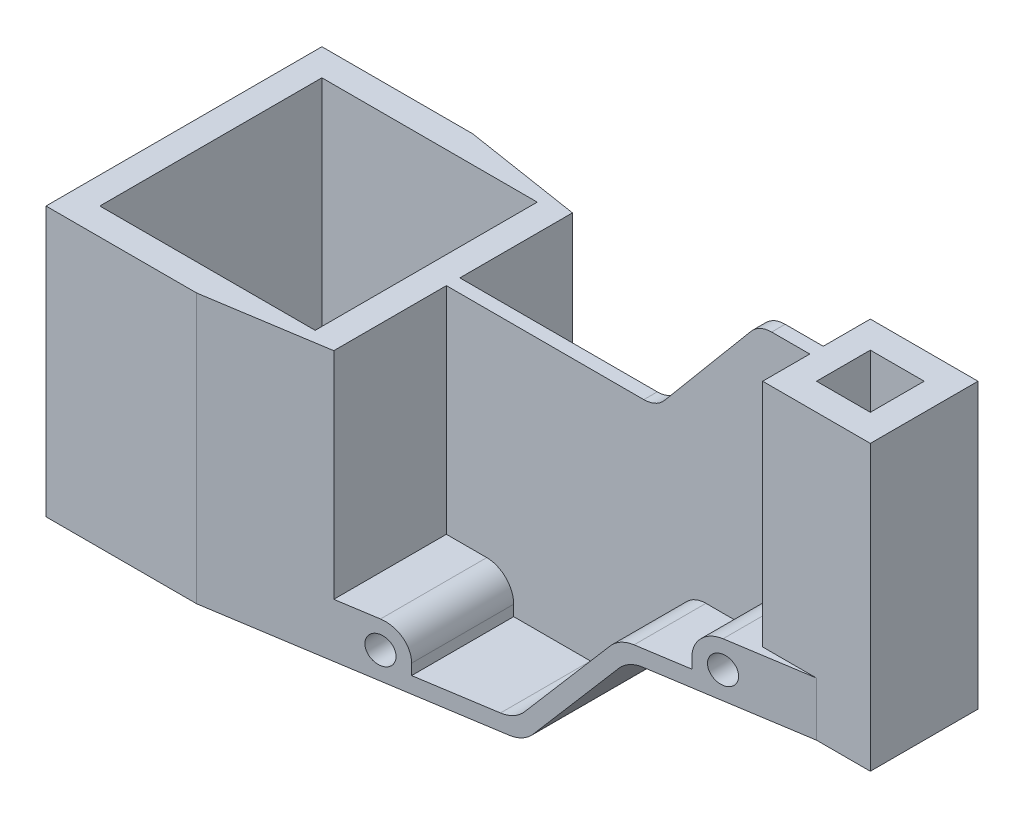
SolidWorks part; units mm, degrees
ref_plane "Front Plane" through (0, 0, 0) normal (0, 0, 1) x (1, 0, 0)
ref_plane "Top Plane" through (0, 0, 0) normal (0, 1, 0) x (1, 0, 0)
ref_plane "Right Plane" through (0, 0, 0) normal (1, 0, 0) x (0, 0, -1)
sketch "Esquisse1" plane through (0, 0, 0) normal (0, 0, 1) x (1, 0, 0)
  line L0 (0, 0) -> (-156.336, 0)
  line L1 (-156.336, 0) -> (-156.336, 100)
  line L2 (-156.336, 100) -> (-56.336, 100)
  line L3 (-56.336, 100) -> (-56.336, 20)
  line L4 (-56.336, 20) -> (-41.336, 20)
  line L5 (-31.336, 6) -> (-2.7978, 6)
  line L6 (4.8626, 9.5721) -> (32.4318, 42.4279)
  line L7 (40.0923, 46) -> (58.664, 46)
  line L8 (58.664, 46) -> (58.664, 50)
  line L10 (7.6604, 3.5721) -> (35.2297, 36.4279)
  line L11 (42.8901, 40) -> (98.664, 40)
  line L13 (-31.336, 10) -> (-31.336, 6)
  line L14 (98.664, 40) -> (98.664, 60)
  line L15 (98.664, 60) -> (68.664, 60)
  line L16 (-56.336, 100) -> (17.0078, 100)
  line L17 (24.6683, 103.5721) -> (56.8526, 141.9279)
  line L18 (64.513, 145.5) -> (118.664, 145.5)
  line L19 (118.664, 145.5) -> (118.664, 40)
  line L20 (118.664, 40) -> (98.664, 40)
  arc A1 (-2.7978, 6) -> (4.8626, 9.5721) centre (-2.7978, 16) ccw
  arc A2 (32.4318, 42.4279) -> (40.0923, 46) centre (40.0923, 36) cw
  arc A4 (35.2297, 36.4279) -> (42.8901, 40) centre (42.8901, 30) cw
  arc A5 (0, 0) -> (7.6604, 3.5721) centre (0, 10) ccw
  arc A6 (-41.336, 20) -> (-31.336, 10) centre (-41.336, 10) cw
  circle A7 centre (-41.336, 10) radius 5
  arc A8 (68.664, 60) -> (58.664, 50) centre (68.664, 50) ccw
  circle A9 centre (68.664, 50) radius 5
  arc A10 (56.8526, 141.9279) -> (64.513, 145.5) centre (64.513, 135.5) cw
  arc A11 (17.0078, 100) -> (24.6683, 103.5721) centre (17.0078, 110) ccw
  point P30 (-106.336, 100)
  point P32 (38.664, 39.0631)
extrude "Boss.-Extru.1" add sketch "Esquisse1" along normal mid plane 102.5 contours L15 A8 L8 L7 A2 L6 A1 L5 L13 A6 L4 L3 L2 L1 L0 A5 L10 A4 L11 L14 A9 A7
sketch "Esquisse5" plane through (0, 0, 0) normal (0, 1, 0) x (1, 0, 0)
  line L0 (-100.336, -51.25) -> (98.664, -20)
  line L2 (98.664, -51.25) -> (98.664, 51.25) construction
  line L3 (98.664, -20) -> (98.664, -51.25)
  line L5 (98.664, 0) -> (75.5696, 0) construction
  line L7 (98.664, 20) -> (98.664, 51.25)
  line L8 (-100.336, 51.25) -> (98.664, 20)
  line L11 (-100.336, 51.25) -> (98.664, 51.25)
  line L12 (-100.336, -51.25) -> (98.664, -51.25)
  point P6 (98.664, 0)
extrude "Enlèv. mat.-Extru.1" cut sketch "Esquisse5" along normal through all
sketch "Esquisse8" plane through (0, 60, 0) normal (0, 1, 0) x (1, 0, 0)
  line L0 (98.664, -20) -> (98.664, 20) construction
  line L1 (78.664, -20) -> (118.664, -20)
  line L2 (78.664, -20) -> (78.664, 20)
  line L3 (78.664, 20) -> (118.664, 20)
  line L4 (118.664, -20) -> (118.664, 20)
  line L5 (78.664, -20) -> (118.664, 20) construction
  line L6 (78.664, 20) -> (118.664, -20) construction
  point P0 (98.664, 0)
  dimension "D1" = 20
extrude "Boss.-Extru.2" add sketch "Esquisse8" along normal blind 85.5
sketch "Esquisse9" plane through (0, 40, 0) normal (0, -1, 0) x (1, 0, 0)
  line L4 (98.664, 20) -> (98.664, -20)
  line L5 (98.664, -20) -> (118.664, -20)
  line L6 (118.664, -20) -> (118.664, 20)
  line L7 (118.664, 20) -> (98.664, 20)
  line L8 (98.664, 20) -> (98.664, -20)
  line L9 (98.664, -20) -> (118.664, -20)
  line L10 (118.664, -20) -> (118.664, 20)
  line L11 (118.664, 20) -> (98.664, 20)
  dimension "D1" = 0
extrude "Boss.-Extru.3" add sketch "Esquisse9" against normal up to surface (20 mm away)
sketch "Esquisse11" plane through (0, 0, 0) normal (0, 0, 1) x (1, 0, 0)
  line L0 (24.6683, 103.5721) -> (56.8526, 141.9279) construction
  line L1 (64.513, 145.5) -> (118.664, 145.5) construction
  line L2 (78.664, 145.5) -> (78.664, 60) construction
  line L3 (98.664, 60) -> (68.664, 60) construction
  line L4 (58.664, 46) -> (58.664, 50) construction
  line L5 (40.0923, 46) -> (58.664, 46) construction
  line L6 (4.8626, 9.5721) -> (32.4318, 42.4279) construction
  line L7 (-31.336, 6) -> (-2.7978, 6) construction
  line L8 (-31.336, 10) -> (-31.336, 6) construction
  line L9 (-56.336, 20) -> (-41.336, 20) construction
  line L10 (-56.336, 100) -> (-56.336, 20) construction
  line L11 (-56.336, 100) -> (17.0078, 100) construction
  line L12 (24.6683, 103.5721) -> (56.8526, 141.9279)
  line L13 (64.513, 145.5) -> (78.664, 145.5)
  line L14 (78.664, 145.5) -> (78.664, 60)
  line L15 (78.664, 60) -> (68.664, 60)
  line L16 (58.664, 46) -> (58.664, 50)
  line L17 (40.0923, 46) -> (58.664, 46)
  line L18 (4.8626, 9.5721) -> (32.4318, 42.4279)
  line L19 (-31.336, 6) -> (-2.7978, 6)
  line L20 (-31.336, 10) -> (-31.336, 6)
  line L21 (-56.336, 20) -> (-41.336, 20)
  line L22 (-56.336, 100) -> (-56.336, 20)
  line L23 (-56.336, 100) -> (17.0078, 100)
  arc A0 (17.0078, 100) -> (24.6683, 103.5721) centre (17.0078, 110) ccw construction
  arc A1 (64.513, 145.5) -> (56.8526, 141.9279) centre (64.513, 135.5) ccw construction
  arc A2 (68.664, 60) -> (58.664, 50) centre (68.664, 50) ccw construction
  arc A3 (40.0923, 46) -> (32.4318, 42.4279) centre (40.0923, 36) ccw construction
  arc A4 (-2.7978, 6) -> (4.8626, 9.5721) centre (-2.7978, 16) ccw construction
  arc A5 (-31.336, 10) -> (-41.336, 20) centre (-41.336, 10) ccw construction
  arc A6 (17.0078, 100) -> (24.6683, 103.5721) centre (17.0078, 110) ccw
  arc A7 (64.513, 145.5) -> (56.8526, 141.9279) centre (64.513, 135.5) ccw
  arc A8 (68.664, 60) -> (58.664, 50) centre (68.664, 50) ccw
  arc A9 (40.0923, 46) -> (32.4318, 42.4279) centre (40.0923, 36) ccw
  arc A10 (-2.7978, 6) -> (4.8626, 9.5721) centre (-2.7978, 16) ccw
  arc A11 (-31.336, 10) -> (-41.336, 20) centre (-41.336, 10) ccw
extrude "Boss.-Extru.4" add sketch "Esquisse11" along normal mid plane 5
sketch "Esquisse12" plane through (0, 100, 0) normal (0, 1, 0) x (1, 0, 0)
  line L0 (-156.336, 51.25) -> (-100.336, 51.25) construction
  line L1 (-146.336, 41.25) -> (-66.336, 41.25)
  line L2 (-146.336, 41.25) -> (-146.336, -41.25)
  line L3 (-146.336, -41.25) -> (-66.336, -41.25)
  line L4 (-66.336, 41.25) -> (-66.336, -41.25)
  line L5 (-156.336, -51.25) -> (-156.336, 51.25) construction
  line L6 (-156.336, -51.25) -> (-100.336, -51.25) construction
  line L7 (-56.336, -44.3405) -> (-56.336, -2.5) construction
  line L8 (118.664, 20) -> (78.664, 20) construction
  line L9 (88.664, 10) -> (108.664, 10)
  line L10 (88.664, 10) -> (88.664, -10)
  line L11 (88.664, -10) -> (108.664, -10)
  line L12 (108.664, 10) -> (108.664, -10)
  line L13 (118.664, -20) -> (118.664, 20) construction
  line L14 (78.664, -20) -> (118.664, -20) construction
  line L15 (78.664, -2.5) -> (78.664, -20) construction
  dimension "D1" = 10
  dimension "D2" = 10
  dimension "D3" = 10
  dimension "D4" = 10
  dimension "D5" = 10
  dimension "D6" = 10
  dimension "D7" = 10
  dimension "D8" = 10
extrude "Enlèv. mat.-Extru.2" cut sketch "Esquisse12" against normal through all and the other way through all
equation "\"A\" = 205"
equation "\"B\"= 100"
equation "\"W\"= \"B\" / 2"
equation "\"X\"= \"A\" / 4"
equation "\"Y\"= \"B\" + 5.5"
equation "\"Z\"= \"B\" + 15"
equation "\"D1@Esquisse1\"=\"B\""
equation "\"D14@Esquisse1\"=\"B\""
equation "\"D12@Esquisse1\"=\"A\""
equation "\"D21@Esquisse1\"=\"X\""
equation "\"D27@Esquisse1\"=\"Z\""
equation "\"D1@Boss.-Extru.1\"=\"X\"*2"
equation "\"D1@Boss.-Extru.2\"=\"Y\"-20"
equation "\"D1@Esquisse5\"=\"A\"-6"
equation "\"D22@Esquisse1\"=\"Y\""
